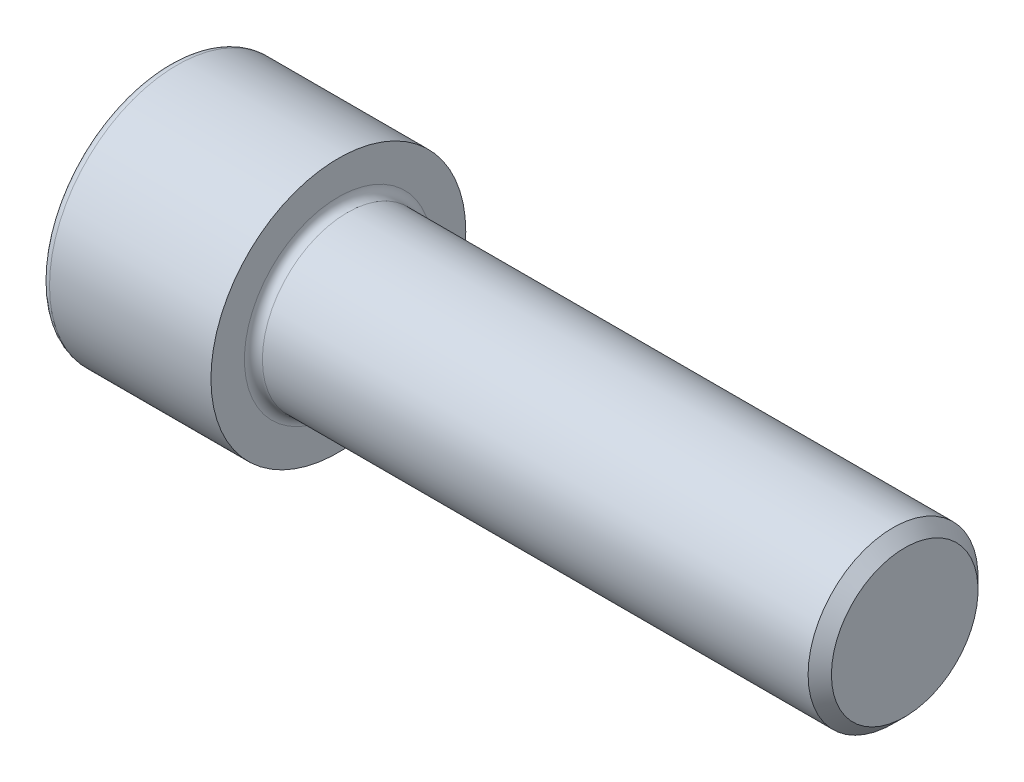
SolidWorks part; units mm, degrees
ref_plane "Plane1" through (0, 0, 0) normal (0, 0, 1) x (1, 0, 0)
ref_plane "Plane2" through (0, 0, 0) normal (0, 1, 0) x (1, 0, 0)
ref_plane "Plane3" through (0, 0, 0) normal (1, 0, 0) x (0, 0, -1)
revolve "Base-Revolve" add sketch "BodySke"
sketch "BodySke" plane through (0, 0, 0) normal (0, 0, 1) x (1, 0, 0)
  line L0 (0, 0) -> (0, 18)
  line L1 (0, 18) -> (24, 18)
  line L2 (24, 18) -> (24, 12)
  line L3 (24, 12) -> (102.352, 12)
  line L4 (104, 10.352) -> (104, 0)
  line L5 (104, 0) -> (0, 0)
  line L6 (-31.75, 0) -> (127, 0) construction
  line L8 (104, 10.352) -> (102.352, 12)
  line L10 (104, -10.352) -> (102.352, -12) construction
  line L11 (27, 9.525) -> (27, 3.175) construction
  line L12 (44, 9.525) -> (44, 3.175) construction
  line L13 (44, 9.525) -> (44, 3.175) construction
  dimension "Diameter" = 24
  dimension "Head_ht" = 24
  dimension "Length" = 80
  dimension "Body_ch_ang" = 45
  dimension "Head_dia" = 36
  dimension "Minor_dia" = 20.704
  dimension "Advance" = 3
  dimension "Thread_nom" = 60
  dimension "Thread_length" = 60
fillet "Fillet1" radius 1.27 1 edges at (24, 0, 12)
fillet "Fillet2" radius 1.2 1 edges at (0, 0, 18)
sketch "Sketch2" plane through (0, 0, 0) normal (0, 0, 1) x (1, 0, 0)
  line L0 (0, 9.6375) -> (12.573, 9.6375)
  line L1 (12.573, 9.6375) -> (18.1372, 0)
  line L2 (-31.75, 0) -> (127, 0) construction
  line L3 (18.1372, 0) -> (0, 0)
  line L4 (0, 0) -> (0, 9.6375)
  line L6 (0, 0) -> (47.625, 0) construction
  dimension "D1" = 9.6375
  dimension "D2" = 60
  dimension "Depth" = 12.573
revolve "Hex-PreBroach" cut sketch "Sketch2" angle 360 about L6
sketch "Sketch3" plane through (0, 0, 0) normal (-1, 0, 0) x (0, 0.5, 0.866)
  line L0 (5.5642, 9.6375) -> (-5.5642, 9.6375)
  line L1 (-5.5642, 9.6375) -> (-11.1284, 0)
  line L2 (5.5642, 9.6375) -> (11.1284, 0)
  line L3 (5.5642, -9.6375) -> (11.1284, 0)
  line L4 (5.5642, -9.6375) -> (-5.5642, -9.6375)
  line L5 (-5.5642, -9.6375) -> (-11.1284, 0)
  dimension "D1" = 9.6375
  dimension "D2" = 9.6375
  dimension "Hex_size" = 19.275
extrude "Hex" cut sketch "Sketch3" against normal blind 12.573
sketch "ThdSchSke" plane through (0, 0, 0) normal (0, 0, 1) x (1, 0, 0)
  line L0 (44, -10.352) -> (42.8461, -12)
  line L1 (44, -10.352) -> (45.1539, -12)
  line L2 (45.1539, -12) -> (45.1539, -15)
  line L3 (-3.175, 0) -> (5.1513, 0) construction
  line L4 (0, 16.8) -> (0, -16.8) construction
  line L5 (45.1539, -15) -> (42.8461, -15)
  line L6 (42.8461, -15) -> (42.8461, -12)
  dimension "Thread_minor" = 20.704
  dimension "Diameter" = 24
  dimension "Start" = 44
  dimension "SideAngle" = 55
  dimension "VeeAngle" = 70
  dimension "Overcut" = 30
revolve "ThreadSchematic" cut sketch "ThdSchSke" angle 360 about L3
pattern_linear "ThdSchPat"
equation "\"D2@Sketch3\" = \"Hex_size@Sketch3\" / 2"
equation "\"D1@Sketch3\" = \"Hex_size@Sketch3\" / 2"
equation "\"D1@Sketch2\" = \"Hex_size@Sketch3\" / 2"
equation "\"Thread_minor@ThreadCosmetic\"  =  \"Minor_dia@BodySke\""
equation "\"Depth@Sketch2\" =  \"Key_eng@Hex\""
equation "\"Thread_length@ThreadCosmetic\" = ((sgn( (\"Length@BodySke\" - \"Advance@BodySke\" * 3.0) - \"Thread_nom@BodySke\" )-1)*( (\"Length@BodySke\" - \"Advance@BodySke\" * 3.0) - \"Thread_nom@BodySke\" ))/-2+ \"Thread_no"
equation "\"Thread_minor@ThdSchSke\" = \"Minor_dia@BodySke\""
equation "\"Diameter@ThdSchSke\" = \"Diameter@BodySke\""
equation "\"Overcut@ThdSchSke\" = \"Diameter@BodySke\" * 1.25"
equation "\"Start@ThdSchSke\" = \"Head_ht@BodySke\" + \"Length@BodySke\" - \"Thread_length@ThreadCosmetic\"  '---Non-countersunk---"
equation "\"Num_threads@ThdSchPat\" = int( \"Thread_length@ThreadCosmetic\" / \"Advance@BodySke\" + 0.999 )  + 1"
equation "\"Advance@ThdSchPat\" = \"Thread_length@ThreadCosmetic\" /  (\"Num_threads@ThdSchPat\" - 1) 'relax it"
equation "\"Num_threads@ThdSchPat\" = \"Num_threads@ThdSchPat\" - sgn( \"Num_threads@ThdSchPat\" - 1) '---chamfered tips only---"
